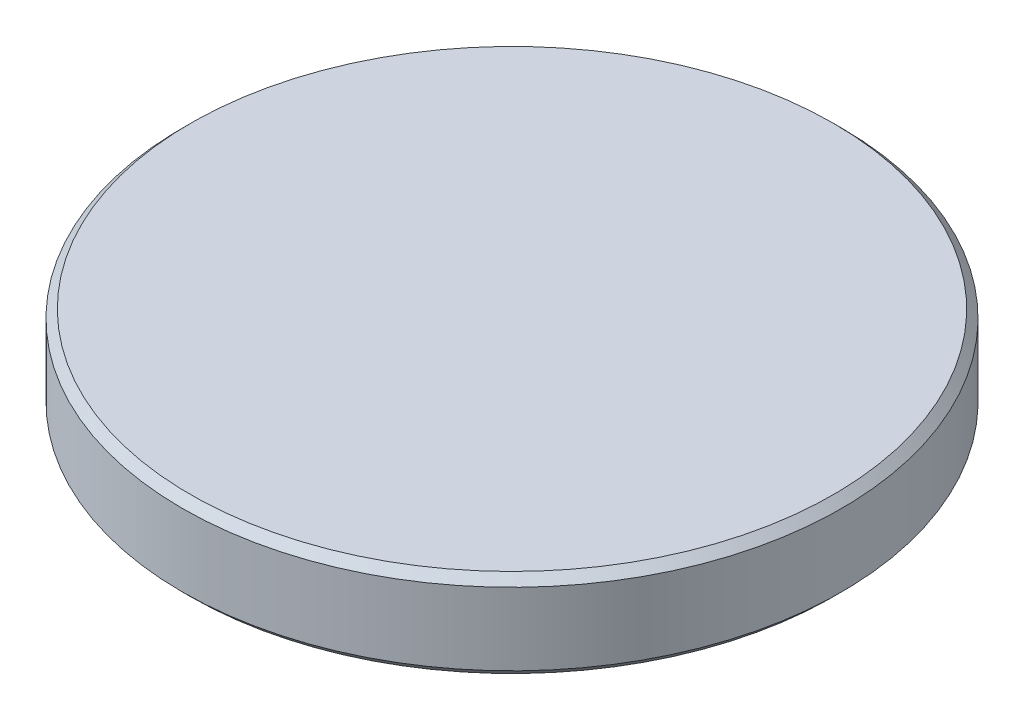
SolidWorks part; units mm, degrees
ref_plane "Front Plane" through (0, 0, 0) normal (0, 0, 1) x (1, 0, 0)
ref_plane "Top Plane" through (0, 0, 0) normal (0, 1, 0) x (1, 0, 0)
ref_plane "Right Plane" through (0, 0, 0) normal (1, 0, 0) x (0, 0, -1)
sketch "Sketch1" plane through (0, 0, 0) normal (0, 1, 0) x (1, 0, 0)
  circle A0 centre (0, 0) radius 20.5
  dimension "D1" = 41
extrude "Extrude1" add sketch "Sketch1" along normal blind 5.5
chamfer "Chamfer1" distance 0.5 angle 45 1 edges at (0, 5.5, 20.5)
shell "Shell1" thickness 2
chamfer "Chamfer2" distance 0.5 angle 45 1 edges at (0, 0, 20.5)
